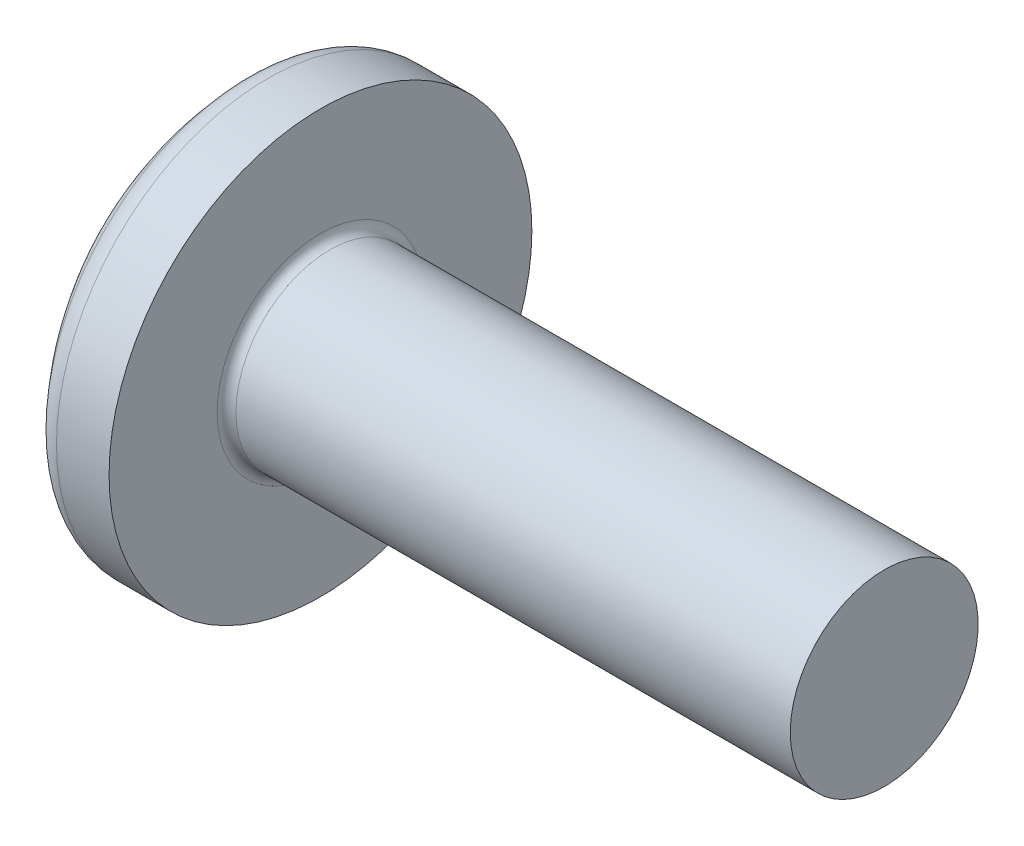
SolidWorks part; units mm, degrees
ref_plane "Plane1" through (0, 0, 0) normal (0, 0, 1) x (1, 0, 0)
ref_plane "Plane2" through (0, 0, 0) normal (0, 1, 0) x (1, 0, 0)
ref_plane "Plane3" through (0, 0, 0) normal (1, 0, 0) x (0, 0, -1)
sketch "BodySke" plane through (0, 0, 0) normal (0, 0, 1) x (1, 0, 0)
  line L0 (1.6, 1) -> (1.6, 2.25)
  line L2 (-25.4, 0) -> (127, 0) construction
  line L3 (7.6, 0) -> (0, 0)
  line L4 (1.6, 1) -> (7.6, 1)
  line L5 (7.6, 1) -> (7.6, 0)
  line L6 (1.0403, 2.25) -> (1.6, 2.25)
  arc A0 (0.8412, 2.1625) -> (0, 0) centre (3.2, 0) ccw
  arc A2 (0.8412, 2.1625) -> (1.0403, 2.25) centre (1.0403, 1.98) cw
  dimension "Head_fillet_rad" = 0.27
  dimension "Head_crown_rad" = 3.2
  dimension "D1" = 6
  dimension "Head_ht" = 1.6
  dimension "Diameter" = 2
  dimension "Head_dia" = 4.5
revolve "Base-Revolve" add sketch "BodySke"
fillet "Fillet1" radius 0.1 1 edges at (1.6, 0, 1)
sketch "Sketch3" plane through (0, 0, 0) normal (1, 0, 0) x (0, 0, -1)
  line L0 (0.37, -0.95) -> (-0.37, -0.95)
  line L1 (0.37, -0.95) -> (0.37, 0.95)
  line L2 (-0.37, 0.95) -> (0.37, 0.95)
  line L3 (-0.37, 0.95) -> (-0.37, -0.95)
  dimension "D1" = 0.95
  dimension "Cross_dia" = 1.9
  dimension "D2" = 0.37
  dimension "Cross_width" = 0.74
ref_plane "Plane4" through (1.75, 0, 0) normal (1, 0, 0) x (0, 0, -1)
sketch "Sketch4" plane through (1.75, 0, 0) normal (1, 0, 0) x (0, 0, -1)
  line L0 (0.37, -0.5275) -> (-0.37, -0.5275)
  line L1 (0.37, -0.5275) -> (0.37, 0.5275)
  line L2 (-0.37, 0.5275) -> (0.37, 0.5275)
  line L3 (-0.37, 0.5275) -> (-0.37, -0.5275)
  dimension "D1" = 0.74
  dimension "D2" = 1.055
  dimension "D3" = 0.37
  dimension "D4" = 0.5275
loft "Recess" cut profiles "Sketch3", "Sketch4"
pattern_circular "RecPat" count 2 every 90 about axis through (0, 0, 0) along (1, 0, 0) of "Recess"
sketch "RecCorSke" plane through (0, 0, 0) normal (0, 0, 1) x (1, 0, 0)
  line L0 (-3.175, 0) -> (15.875, 0) construction
  line L1 (-25.4, 0) -> (127, 0) construction
  line L2 (0, 0) -> (0, 0.6784)
  line L3 (0, 0.6784) -> (1.75, 0.556)
  line L4 (1.75, 0.556) -> (1.9307, 0)
  line L5 (1.9307, 0) -> (0, 0)
  dimension "Diameter" = 1.112
  dimension "Depth" = 1.75
  dimension "Draft_angle" = 4
  dimension "Bottom_angle" = 18
revolve "RecessCore" cut sketch "RecCorSke" angle 360 about L0
